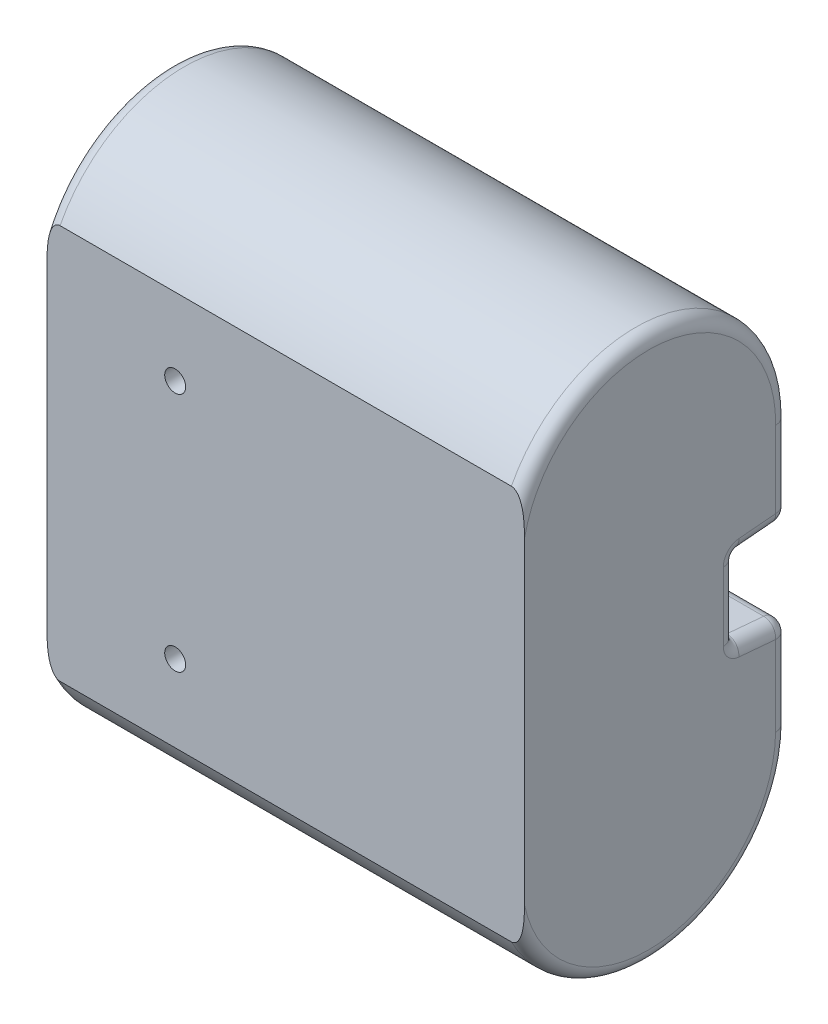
SolidWorks part; units mm, degrees
ref_plane "Plan de face" through (0, 0, 0) normal (0, 0, 1) x (1, 0, 0)
ref_plane "Plan de dessus" through (0, 0, 0) normal (0, 1, 0) x (1, 0, 0)
ref_plane "Plan de droite" through (0, 0, 0) normal (1, 0, 0) x (0, 0, -1)
imported_body "Importée1"
other "Diamètre du perçage Ø16.0 (16)1"
